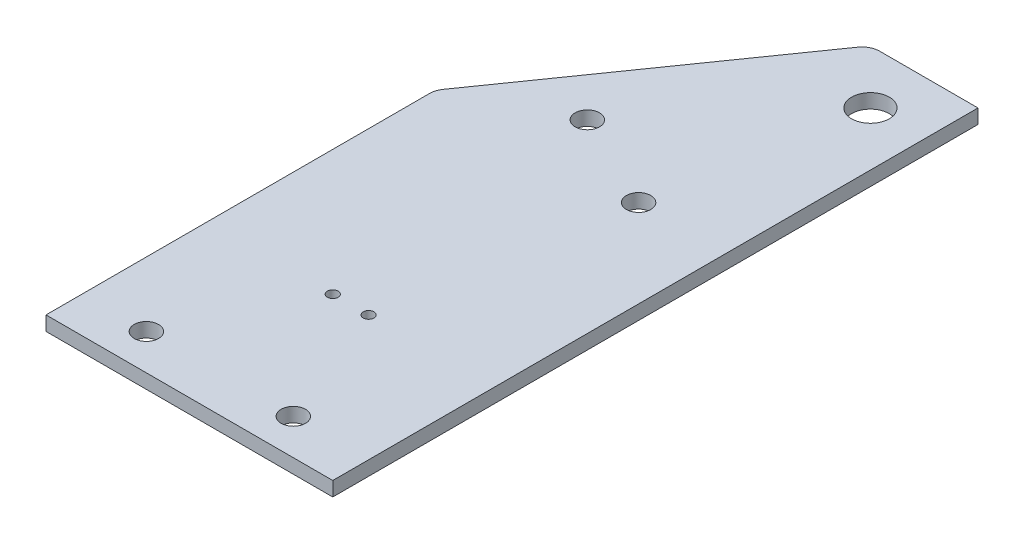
SolidWorks part; units mm, degrees
ref_plane "Plan de face" through (0, 0, 0) normal (0, 0, 1) x (1, 0, 0)
ref_plane "Plan de dessus" through (0, 0, 0) normal (0, 1, 0) x (1, 0, 0)
ref_plane "Plan de droite" through (0, 0, 0) normal (1, 0, 0) x (0, 0, -1)
mirrored part "DF0404300_Rendre symétrique"
other "<DF040430>-<Diamètre du perçage M3.0 (3.000000)2>"
